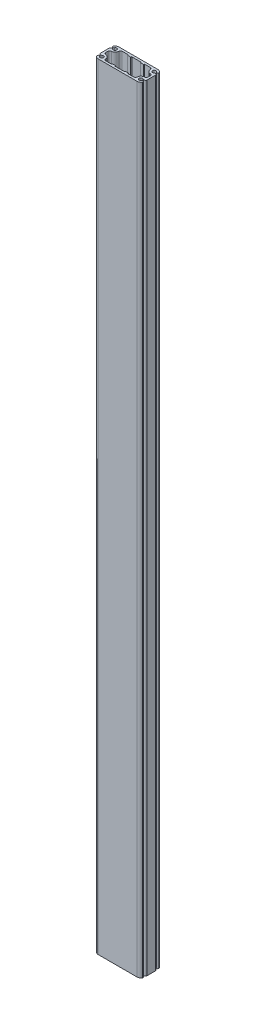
SolidWorks part; units mm, degrees
ref_plane "Alzado" through (0, 0, 0) normal (0, 0, 1) x (1, 0, 0)
ref_plane "Planta" through (0, 0, 0) normal (0, 1, 0) x (1, 0, 0)
ref_plane "Vista lateral" through (0, 0, 0) normal (1, 0, 0) x (0, 0, -1)
sketch "Croquis2" plane through (0, 0, 0) normal (0, 1, 0) x (1, 0, 0)
  line L0 (-183.2758, 0) -> (156.0252, 0) construction
  line L1 (0, 113.0945) -> (0, -113.0945) construction
  line L2 (90, -15.8204) -> (90, 15.8204)
  line L3 (75.5, 40) -> (-75.5, 40)
  line L4 (-17.4827, 32) -> (17.4827, 32)
  line L5 (20, 29) -> (30, 29)
  line L6 (123.5786, 25.5) -> (27.4214, 25.5) construction
  line L7 (75.5, 71.4027) -> (75.5, -20.4027) construction
  line L8 (82, 4.5) -> (82, -4.5)
  line L9 (20, 29) -> (17.4827, 32)
  line L10 (30, 29) -> (32.5173, 32)
  line L11 (32.5173, 32) -> (54.5, 32)
  line L12 (75.5, -71.4027) -> (75.5, 20.4027) construction
  line L13 (123.5786, -25.5) -> (27.4214, -25.5) construction
  line L14 (32.5173, -32) -> (54.5, -32)
  line L15 (30, -29) -> (32.5173, -32)
  line L16 (20, -29) -> (17.4827, -32)
  line L17 (20, -29) -> (30, -29)
  line L18 (-17.4827, -32) -> (17.4827, -32)
  line L19 (75.5, -40) -> (-75.5, -40)
  line L20 (-123.5786, -25.5) -> (-27.4214, -25.5) construction
  line L21 (-75.5, -71.4027) -> (-75.5, 20.4027) construction
  line L22 (-75.5, 71.4027) -> (-75.5, -20.4027) construction
  line L23 (-123.5786, 25.5) -> (-27.4214, 25.5) construction
  line L24 (-20, -29) -> (-30, -29)
  line L25 (-20, -29) -> (-17.4827, -32)
  line L26 (-30, -29) -> (-32.5173, -32)
  line L27 (-32.5173, -32) -> (-54.5, -32)
  line L28 (-32.5173, 32) -> (-54.5, 32)
  line L29 (-30, 29) -> (-32.5173, 32)
  line L30 (-20, 29) -> (-17.4827, 32)
  line L31 (-82, 4.5) -> (-82, -4.5)
  line L32 (-20, 29) -> (-30, 29)
  line L33 (-90, -15.8204) -> (-90, 15.8204)
  arc A0 (88.1963, 32.5039) -> (75.5, 40) centre (75.5, 25.5) ccw
  arc A1 (81.1914, 28.6397) -> (79.722, 20.5579) centre (75.5, 25.5) ccw
  arc A3 (61, 25.5) -> (54.5, 32) centre (54.5, 25.5) ccw
  arc A4 (81.1914, 28.6397) -> (88.1963, 32.5039) centre (84.6939, 30.5718) ccw
  arc A5 (90, 15.8204) -> (79.722, 20.5579) centre (83.7692, 15.8204) ccw
  arc A6 (82, 4.5) -> (75.5, 11) centre (75.5, 4.5) ccw
  arc A7 (61, 25.5) -> (75.5, 11) centre (75.5, 25.5) ccw
  arc A8 (61, -25.5) -> (75.5, -11) centre (75.5, -25.5) cw
  arc A9 (82, -4.5) -> (75.5, -11) centre (75.5, -4.5) cw
  arc A10 (90, -15.8204) -> (79.722, -20.5579) centre (83.7692, -15.8204) cw
  arc A11 (81.1914, -28.6397) -> (88.1963, -32.5039) centre (84.6939, -30.5718) cw
  arc A12 (61, -25.5) -> (54.5, -32) centre (54.5, -25.5) cw
  arc A13 (81.1914, -28.6397) -> (79.722, -20.5579) centre (75.5, -25.5) cw
  arc A14 (88.1963, -32.5039) -> (75.5, -40) centre (75.5, -25.5) cw
  arc A15 (-88.1963, -32.5039) -> (-75.5, -40) centre (-75.5, -25.5) ccw
  arc A16 (-81.1914, -28.6397) -> (-79.722, -20.5579) centre (-75.5, -25.5) ccw
  arc A17 (-61, -25.5) -> (-54.5, -32) centre (-54.5, -25.5) ccw
  arc A18 (-81.1914, -28.6397) -> (-88.1963, -32.5039) centre (-84.6939, -30.5718) ccw
  arc A19 (-90, -15.8204) -> (-79.722, -20.5579) centre (-83.7692, -15.8204) ccw
  arc A20 (-82, -4.5) -> (-75.5, -11) centre (-75.5, -4.5) ccw
  arc A21 (-61, -25.5) -> (-75.5, -11) centre (-75.5, -25.5) ccw
  arc A22 (-61, 25.5) -> (-75.5, 11) centre (-75.5, 25.5) cw
  arc A23 (-82, 4.5) -> (-75.5, 11) centre (-75.5, 4.5) cw
  arc A24 (-90, 15.8204) -> (-79.722, 20.5579) centre (-83.7692, 15.8204) cw
  arc A25 (-81.1914, 28.6397) -> (-88.1963, 32.5039) centre (-84.6939, 30.5718) cw
  arc A26 (-61, 25.5) -> (-54.5, 32) centre (-54.5, 25.5) cw
  arc A27 (-81.1914, 28.6397) -> (-79.722, 20.5579) centre (-75.5, 25.5) cw
  arc A28 (-88.1963, 32.5039) -> (-75.5, 40) centre (-75.5, 25.5) cw
  point P6 (0, 0)
  point P8 (-90, 0)
  point P9 (0, 40)
  point P17 (75.5, 25.5)
  point P20 (75.5, 25.5)
  point P56 (82, 0)
  point P58 (90, 0)
  point P94 (0, -40)
  point P95 (0, -32)
  point P102 (0, 32)
  point P103 (-82, 0)
  dimension "D5" = 14.5
  dimension "D6" = 6.5
  dimension "D7" = 6.2308
  dimension "D8" = 9.1939
  dimension "D1" = 90
  dimension "D2" = 40
  dimension "D3" = 8
  dimension "D4" = 8
  dimension "D9" = 21
  dimension "D10" = 10
  dimension "D11" = 20
  dimension "D12" = 3
  dimension "D13" = 50
  dimension "D14" = 50
extrude "Saliente-Extruir1" add sketch "Croquis2" along normal blind 3000
